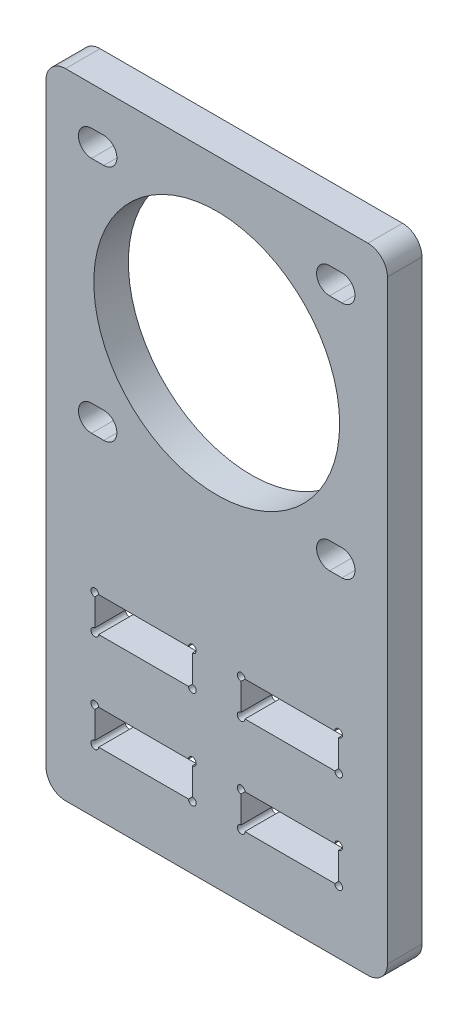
SolidWorks part; units mm, degrees
ref_plane "Front Plane" through (0, 0, 0) normal (0, 0, 1) x (1, 0, 0)
ref_plane "Top Plane" through (0, 0, 0) normal (0, 1, 0) x (1, 0, 0)
ref_plane "Right Plane" through (0, 0, 0) normal (1, 0, 0) x (0, 0, -1)
sketch "Sketch1" plane through (0, 0, 0) normal (0, 0, 1) x (1, 0, 0)
  line L1 (0, 0) -> (44.45, 0)
  line L2 (0, 0) -> (0, 82.55)
  line L3 (0, 82.55) -> (44.45, 82.55)
  line L4 (44.45, 0) -> (44.45, 82.55)
  dimension "D1" = 82.55
  dimension "D2" = 44.45
extrude "Boss-Extrude1" add sketch "Sketch1" along normal blind 4.5
sketch "Sketch8" plane through (0, 0, 4.5) normal (0, 0, 1) x (1, 0, 0)
  line L0 (0, 82.55) -> (0, 0) construction
  line L3 (44.45, 82.55) -> (0, 82.55) construction
  circle A0 centre (22.225, 60.325) radius 16.002
  point P4 (22.225, 82.55)
  dimension "D1" = 22.225
  dimension "D2" = 22.225
extrude "Cut-Extrude1" cut sketch "Sketch8" against normal blind 4.5
sketch "Sketch9" plane through (0, 0, 4.5) normal (0, 0, 1) x (1, 0, 0)
  point P0 (6.725, 75.825)
  point P5 (37.725, 75.825)
  point P6 (22.225, 60.325)
  point P8 (37.725, 44.825)
  point P9 (6.725, 44.825)
  dimension "D1" = 15.5
  dimension "D3" = 2
  dimension "D4" = 2
  dimension "D5" = 15.5
hole_wizard "M3 Clearance Slot1" positions "Sketch11" profile "Sketch10" size "M3" standard "ANSI Metric"
sketch "Sketch11" plane through (0, 0, 4.5) normal (0, 0, 1) x (1, 0, 0)
  line L0 (4.225, 44.825) -> (9.225, 44.825) construction
  point P0 (6.725, 44.825)
  point P3 (6.725, 75.825)
  point P6 (37.725, 75.825)
  point P9 (37.725, 44.825)
  dimension "D1" = 5
sketch "Sketch10" plane through (6.725, 44.825, 4.5) normal (1, 0, 0) x (0, -1, 0)
  line L0 (0, 0) -> (0, 26.4215)
  line L1 (0, 26.4215) -> (1.7, 25.4)
  line L2 (1.7, 25.4) -> (1.7, 0)
  line L5 (1.7, 0) -> (0, 0)
  line L10 (0, 26.4215) -> (-1.7, 25.4) construction
  line L11 (0, -6.35) -> (0, 107.95) construction
  dimension "Hole Dia." = 3.4
  dimension "Hole Depth" = 25.4
  dimension "Drill Angle" = 118
fillet "Fillet1" radius 2.54 4 edges at (0, 0, 2.25) (44.45, 0, 2.25) (0, 82.55, 2.25) (44.45, 82.55, 2.25)
sketch "Sketch13" plane through (0, 0, 4.5) normal (0, 0, 1) x (1, 0, 0)
  line L0 (0, 80.01) -> (0, 2.54) construction
  line L1 (6.35, 25.4) -> (19.05, 25.4)
  line L2 (6.35, 25.4) -> (6.35, 20.9)
  line L3 (6.35, 20.9) -> (19.05, 20.9)
  line L4 (19.05, 25.4) -> (19.05, 20.9)
  line L5 (12.7, 25.4) -> (12.7, 20.9) construction
  line L6 (41.91, 82.55) -> (2.54, 82.55) construction
  line L7 (6.35, 23.15) -> (19.05, 23.15) construction
  line L8 (38.1, 20.9) -> (25.4, 20.9)
  line L9 (38.1, 25.4) -> (38.1, 20.9)
  line L10 (38.1, 25.4) -> (25.4, 25.4)
  line L11 (25.4, 25.4) -> (25.4, 20.9)
  line L12 (6.35, 12.7) -> (19.05, 12.7)
  line L13 (6.35, 12.7) -> (6.35, 8.2)
  line L14 (6.35, 8.2) -> (19.05, 8.2)
  line L15 (19.05, 12.7) -> (19.05, 8.2)
  line L16 (38.1, 12.7) -> (25.4, 12.7)
  line L17 (25.4, 12.7) -> (25.4, 8.2)
  line L18 (38.1, 8.2) -> (25.4, 8.2)
  line L19 (38.1, 12.7) -> (38.1, 8.2)
  line L20 (22.225, 0) -> (22.225, 82.55) construction
  line L21 (2.54, 0) -> (41.91, 0) construction
  arc A0 (6.85, 25.4) -> (6.35, 24.9) centre (6.35, 25.4) ccw
  arc A1 (19.05, 24.9) -> (18.55, 25.4) centre (19.05, 25.4) ccw
  arc A2 (19.05, 21.4) -> (18.55, 20.9) centre (19.05, 20.9) cw
  arc A3 (6.85, 20.9) -> (6.35, 21.4) centre (6.35, 20.9) cw
  arc A4 (6.85, 12.7) -> (6.35, 12.2) centre (6.35, 12.7) ccw
  arc A5 (19.05, 12.2) -> (18.55, 12.7) centre (19.05, 12.7) ccw
  arc A6 (19.05, 8.7) -> (18.55, 8.2) centre (19.05, 8.2) cw
  arc A7 (6.85, 8.2) -> (6.35, 8.7) centre (6.35, 8.2) cw
  arc A8 (25.9, 25.4) -> (25.4, 24.9) centre (25.4, 25.4) ccw
  arc A9 (25.4, 21.4) -> (25.9, 20.9) centre (25.4, 20.9) ccw
  arc A10 (38.1, 21.4) -> (37.6, 20.9) centre (38.1, 20.9) cw
  arc A11 (38.1, 24.9) -> (37.6, 25.4) centre (38.1, 25.4) ccw
  arc A12 (25.9, 12.7) -> (25.4, 12.2) centre (25.4, 12.7) ccw
  arc A13 (25.4, 8.7) -> (25.9, 8.2) centre (25.4, 8.2) ccw
  arc A14 (38.1, 8.7) -> (37.6, 8.2) centre (38.1, 8.2) cw
  arc A15 (38.1, 12.2) -> (37.6, 12.7) centre (38.1, 12.7) ccw
  dimension "D8" = 0.5
  dimension "D9" = 0.5
  dimension "D10" = 0.5
  dimension "D11" = 0.5
  dimension "D12" = 0.5
  dimension "D13" = 0.5
  dimension "D14" = 0.5
  dimension "D15" = 0.5
  dimension "D1" = 12.7
  dimension "D2" = 4.5
  dimension "D3" = 6.35
  dimension "D5" = 57.15
  dimension "D6" = 4.5
  dimension "D7" = 0
  dimension "D4" = 2
extrude "Cut-Extrude2" cut sketch "Sketch13" against normal through all contours L1 A0 L2 | L4 L1 L2 L3 | A3 L3 L2 | A2 L4 L3 | L4 A1 L1 | L10 A8 L11 | L10 L11 L8 L9 | L11 A9 L8 | L15 L12 L13 L14 | L19 L16 L17 L18 | L9 A11 L10 | A10 L9 L8 | L19 A15 L16 | A14 L19 L18 | L17 A13 L18 | L16 A12 L17 | A6 L15 L14 | L15 A5 L12 | L12 A4 L13 | A7 L14 L13
equation "\"D\"=0.906911"
